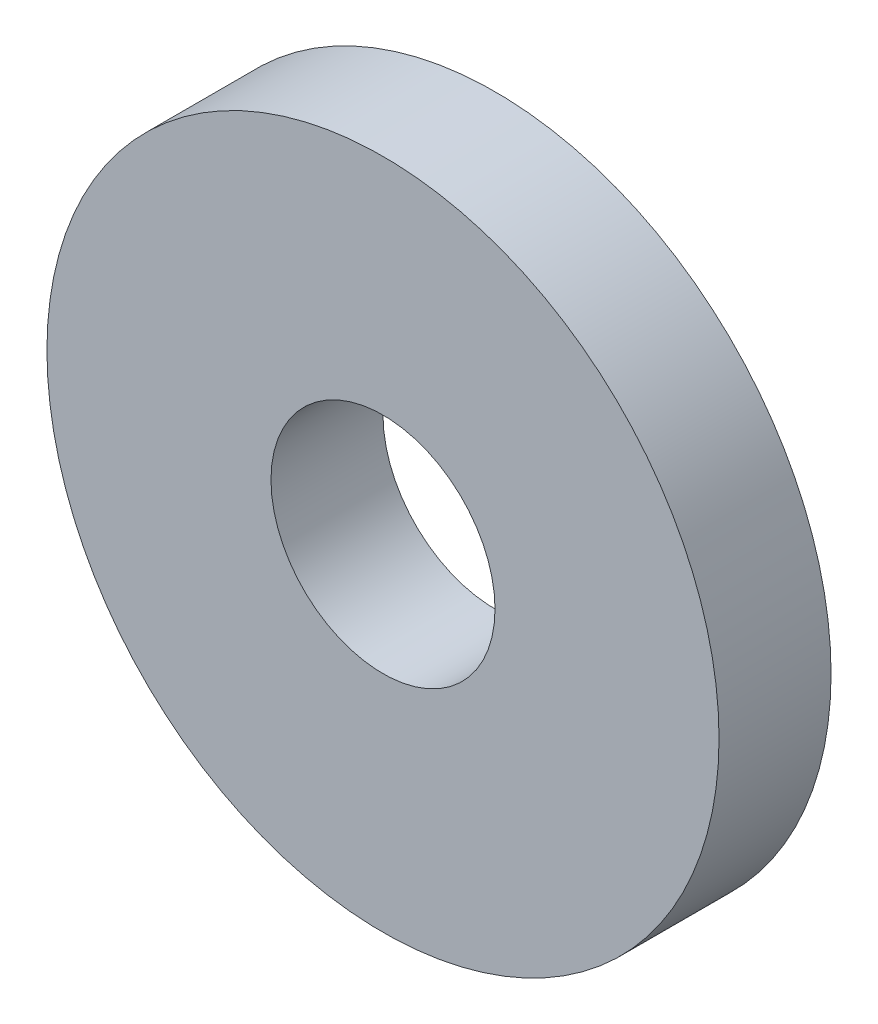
SolidWorks part; units mm, degrees
ref_plane "Front Plane" through (0, 0, 0) normal (0, 0, 1) x (1, 0, 0)
ref_plane "Top Plane" through (0, 0, 0) normal (0, 1, 0) x (1, 0, 0)
ref_plane "Right Plane" through (0, 0, 0) normal (1, 0, 0) x (0, 0, -1)
sketch "Sketch1" plane through (0, 0, 0) normal (0, 0, 1) x (1, 0, 0)
  circle A0 centre (0, 0) radius 3
  dimension "D1" = 6
extrude "Boss-Extrude1" add sketch "Sketch1" along normal blind 1
sketch "Sketch2" plane through (0, 0, 1) normal (0, 0, 1) x (1, 0, 0)
  circle A0 centre (0, 0) radius 1
  dimension "D1" = 2
extrude "Cut-Extrude1" cut sketch "Sketch2" against normal blind 1
